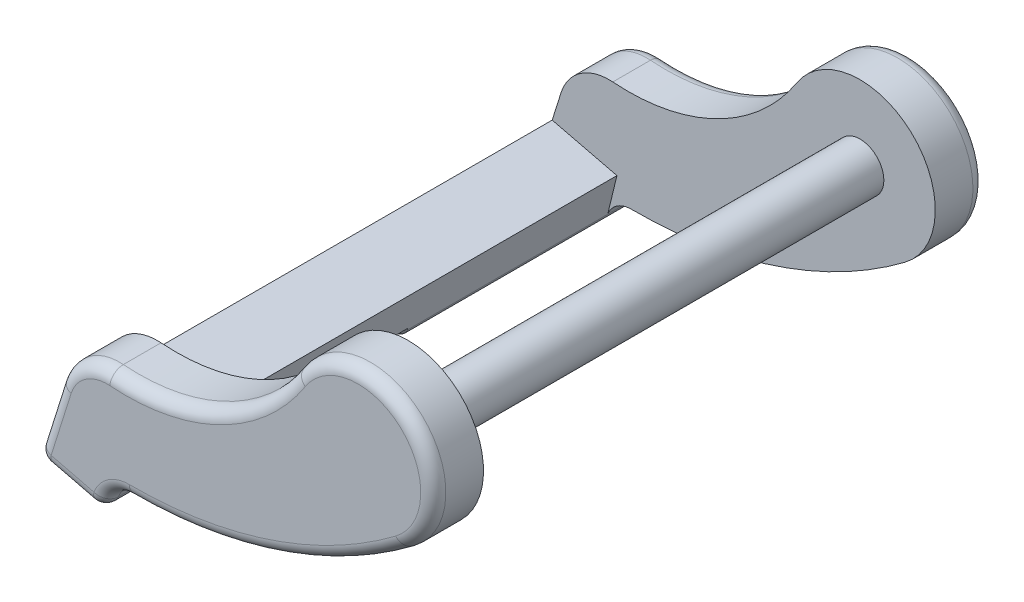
SolidWorks part; units mm, degrees
ref_plane "Front" through (0, 0, 0) normal (0, 0, 1) x (1, 0, 0)
ref_plane "Top" through (0, 0, 0) normal (0, 1, 0) x (1, 0, 0)
ref_plane "Right" through (0, 0, 0) normal (1, 0, 0) x (0, 0, -1)
sketch "Sketch1" plane through (0, 0, 0) normal (0, 0, 1) x (1, 0, 0)
  line L0 (-8.1853, -56.5205) -> (-10.8636, -55.8705)
  line L1 (-7.8459, -55.4405) -> (-8.1853, -56.5205)
  line L2 (-10.8636, -55.8705) -> (-9.908, -52.83)
  arc A0 (3.8077, -51.824) -> (-0.5196, -47.8013) centre (2, -49.4297) ccw
  arc A1 (3.8077, -51.824) -> (-7.8459, -55.4405) centre (-7.0384, -37.4587) cw
  arc A2 (-0.5196, -47.8013) -> (-7.8477, -51.4355) centre (-7.2384, -43.4588) cw
  arc A3 (-7.8477, -51.4355) -> (-9.908, -52.83) centre (-8, -53.4297) ccw
  dimension "D1" = 6
  dimension "D2" = 4
  dimension "D3" = 10
  dimension "D4" = 4
  dimension "D8" = 8
  dimension "D9" = 18
  dimension "D5" = 2.75
extrude "Base-Extrude" add sketch "Sketch1" along normal mid plane 22
shell "Shell1" thickness 2
fillet "Fillet3" radius 1 1 edges at (-1.7033, -54.6498, 11)
fillet "Fillet4" radius 0.5 5 edges at (-8.1853, -56.5205, 0) (-10.8636, -55.8705, 0) (-8.1284, -56.3395, 11) (-8.0716, -56.1586, 0) (-8.1284, -56.3395, -11)
fillet "Fillet6" radius 0.5 18 edges at (-3.684, -50.6258, 11) (-9.121, -51.7735, 11) (-10.3057, -54.0954, 11) (-1.3545, -54.5377, 11) (-1.3545, -54.5377, -11) (-7.6834, -55.634, -11) (-7.6834, -55.634, 11) (-9.4908, -56.2036, -11) (-10.6618, -55.7565, -11) (-8.2866, -56.3673, -11) (-9.4908, -56.2036, 11) (-10.6618, -55.7565, 11) (-8.2866, -56.3673, 11) (4.0426, -47.2325, 11) (-10.3057, -54.0954, -11) (-9.121, -51.7735, -11) (-3.684, -50.6258, -11) (4.0426, -47.2325, -11)
sketch "Sketch2" plane through (0, 0, 9) normal (0, 0, -1) x (-1, 0, 0)
  circle A0 centre (-2, -49.4297) radius 0.95
extrude "Boss-Extrude1" add sketch "Sketch2" along normal up to surface (18 mm away)
sketch "Sketch3" plane through (-13.4082, -55.253, 0) normal (-0.2358, -0.9718, 0) x (0.9718, -0.2358, 0)
  line L0 (5.4053, 10.5) -> (5.4053, -10.5) construction
  line L1 (5.4053, 9) -> (5.4053, -9)
  line L2 (8.4699, 9) -> (8.4699, -9) construction
  line L3 (8.4699, 9) -> (8.4699, -9)
  line L4 (8.4699, 9) -> (5.4053, 9)
  line L5 (8.4699, -9) -> (5.4053, -9)
extrude "Cut-Extrude1" cut sketch "Sketch3" against normal through all
sketch "Sketch5" plane through (-13.4082, -55.253, 0) normal (-0.2358, -0.9718, 0) x (0.9718, -0.2358, 0)
  line L1 (5.8625, 0.95) -> (3.996, 0.95)
  line L2 (5.8625, -0.95) -> (5.8625, 0.95)
  line L3 (3.996, -0.95) -> (5.8625, -0.95)
  arc A0 (3.996, 0.95) -> (3.996, -0.95) centre (3.996, 0) ccw
extrude "Cut-Extrude2" cut sketch "Sketch5" against normal blind 0.5
fillet "Fillet8" radius 0.1 9 edges at (-8.0448, -56.0723, 0.95) (-8.0448, -56.0723, -0.95) (-10.4361, -55.9645, 0.1376) (-9.0811, -56.3031, -0.95) (-9.0811, -56.3031, 0.95) (-10.0043, -56.079, 0.8118) (-10.0043, -56.079, -0.8118) (-8.2866, -56.3673, -0.95) (-8.2866, -56.3673, 0.95)
